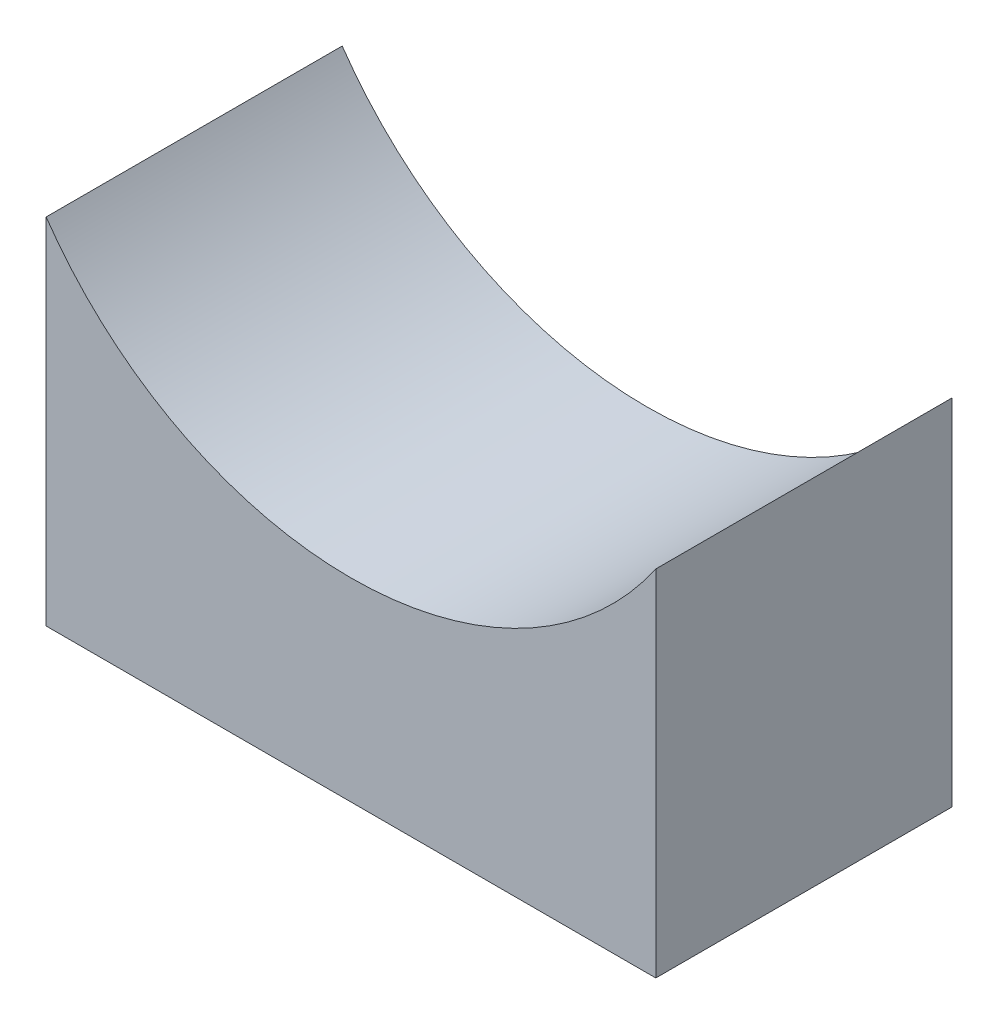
SolidWorks part; units mm, degrees
ref_plane "Front Plane" through (0, 0, 0) normal (0, 0, 1) x (1, 0, 0)
ref_plane "Top Plane" through (0, 0, 0) normal (0, 1, 0) x (1, 0, 0)
ref_plane "Right Plane" through (0, 0, 0) normal (1, 0, 0) x (0, 0, -1)
sketch "Sketch1" plane through (0, 0, 0) normal (0, 0, 1) x (1, 0, 0)
  line L1 (-205.9142, -141.7722) -> (-205.9142, -381.0757)
  line L2 (-205.9142, -381.0757) -> (197.0734, -381.0757)
  line L5 (205.9142, -141.7722) -> (205.9142, -381.0757)
  line L6 (205.9142, -381.0757) -> (146.7996, -381.0757)
  arc A0 (-205.9142, -141.7722) -> (205.9142, -141.7722) centre (0, 0) ccw
  dimension "D1" = 500
extrude "Boss-Extrude1" add sketch "Sketch1" along normal blind 200 contours A0 L1 L2 L6 L5
